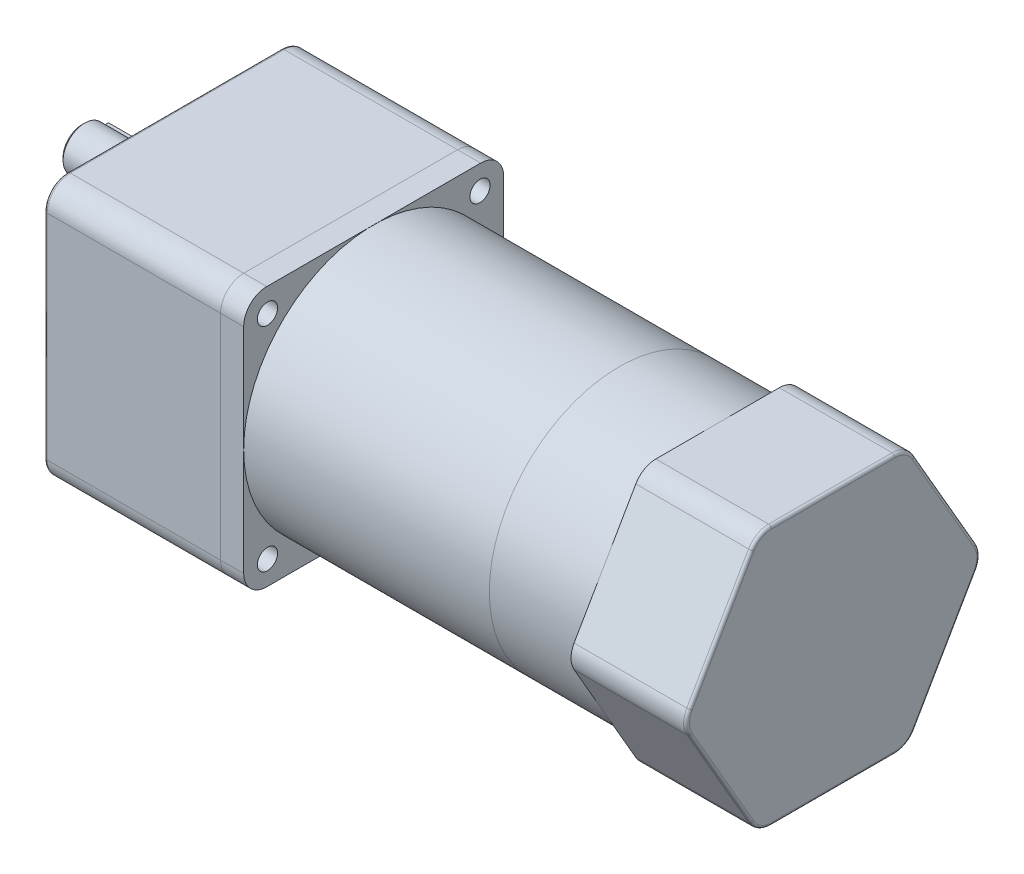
SolidWorks part; units mm, degrees
ref_plane "前视基准面" through (0, 0, 0) normal (0, 0, 1) x (1, 0, 0)
ref_plane "上视基准面" through (0, 0, 0) normal (0, 1, 0) x (1, 0, 0)
ref_plane "右视基准面" through (0, 0, 0) normal (1, 0, 0) x (0, 0, -1)
sketch "草图1" plane through (0, 0, 0) normal (1, 0, 0) x (0, 0, -1)
  line L1 (-37, -45) -> (37, -45)
  line L2 (-45, -37) -> (-45, 37)
  line L3 (-37, 45) -> (37, 45)
  line L4 (45, -37) -> (45, 37)
  line L5 (-45, -45) -> (45, 45) construction
  line L6 (-45, 45) -> (45, -45) construction
  arc A0 (-37, -45) -> (-45, -37) centre (-37, -37) cw
  arc A1 (-45, 37) -> (-37, 45) centre (-37, 37) cw
  arc A2 (37, 45) -> (45, 37) centre (37, 37) cw
  arc A3 (37, -45) -> (45, -37) centre (37, -37) ccw
  point P0 (0, 0)
  dimension "D1" = 8
extrude "凸台-拉伸1" add sketch "草图1" along normal blind 61
sketch "草图2" plane through (61, 0, 0) normal (1, 0, 0) x (0, 0, -1)
  line L0 (37, 45) -> (-37, 45) construction
  line L1 (-37, -45) -> (37, -45)
  line L2 (-45, -37) -> (-45, 37)
  line L3 (-37, 45) -> (37, 45)
  line L4 (45, -37) -> (45, 37)
  line L5 (-45, -45) -> (45, 45) construction
  line L6 (-45, 45) -> (45, -45) construction
  arc A0 (37, 45) -> (45, 37) centre (37, 37) cw
  arc A1 (37, -45) -> (45, -37) centre (37, -37) ccw
  arc A2 (-37, -45) -> (-45, -37) centre (-37, -37) cw
  arc A3 (-45, 37) -> (-37, 45) centre (-37, 37) cw
  point P0 (0, 0)
  dimension "D1" = 8
extrude "凸台-拉伸2" add sketch "草图2" along normal blind 8 separate body
sketch "草图3" plane through (69, 0, 0) normal (1, 0, 0) x (0, 0, -1)
  circle A0 centre (0, 0) radius 45
extrude "凸台-拉伸3" add sketch "草图3" along normal blind 85 separate body
sketch "草图4" plane through (154, 0, 0) normal (1, 0, 0) x (0, 0, -1)
  circle A0 centre (0, 0) radius 45
extrude "凸台-拉伸4" add sketch "草图4" along normal blind 34 separate body
sketch "草图5" plane through (188, 0, 0) normal (1, 0, 0) x (0, 0, -1)
  line L1 (21.362, 45) -> (-21.362, 45)
  line L2 (-28.2902, 41) -> (-49.6521, 4)
  line L3 (-49.6521, -4) -> (-28.2902, -41)
  line L4 (-21.362, -45) -> (21.362, -45)
  line L5 (28.2902, -41) -> (49.6521, -4)
  line L6 (49.6521, 4) -> (28.2902, 41)
  circle A0 centre (0, 0) radius 45 construction
  arc A1 (-49.6521, 4) -> (-49.6521, -4) centre (-42.7239, 0) ccw
  arc A2 (-28.2902, -41) -> (-21.362, -45) centre (-21.362, -37) ccw
  arc A3 (21.362, -45) -> (28.2902, -41) centre (21.362, -37) ccw
  arc A4 (49.6521, -4) -> (49.6521, 4) centre (42.7239, 0) ccw
  arc A5 (21.362, 45) -> (28.2902, 41) centre (21.362, 37) cw
  arc A6 (-21.362, 45) -> (-28.2902, 41) centre (-21.362, 37) ccw
  dimension "D1" = 8
extrude "凸台-拉伸5" add sketch "草图5" along normal blind 40 separate body
fillet "圆角1" radius 1 12 edges at (228, 22.5, 38.9711) (228, 43.9282, 25.362) (228, 45, 0) (228, 43.9282, -25.362) (228, 22.5, -38.9711) (228, 0, -50.7239) (228, -22.5, -38.9711) (228, -43.9282, -25.362) (228, -45, 0) (228, -43.9282, 25.362) (228, -22.5, 38.9711) (228, 0, 50.7239)
fillet "圆角2" radius 1 8 edges at (0, -45, 0) (0, -42.6569, -42.6569) (0, 0, -45) (0, 42.6569, -42.6569) (0, 45, 0) (0, 42.6569, 42.6569) (0, 0, 45) (0, -42.6569, 42.6569)
sketch "草图6" plane through (0, 0, 0) normal (-1, 0, 0) x (0, 0, 1)
  point P19 (36.7696, 36.7696)
  point P20 (36.7696, -36.7696)
  point P21 (-36.7696, -36.7696)
  point P22 (-36.7696, 36.7696)
hole_wizard "M6 螺纹孔1" positions "3D草图1" profile "草图7" tap size "M6" standard "GB"
sketch3d "3D草图1"
  point P0 (0, 36.7696, 36.7696)
  point P3 (0, -36.7696, 36.7696)
  point P6 (0, 36.7696, -36.7696)
  point P9 (0, -36.7696, -36.7696)
sketch "草图7" plane through (0, 36.7696, 36.7696) normal (0, 1, 0) x (0, 0, 1)
  line L0 (0, 0) -> (0, 18.5022)
  line L1 (0, 18.5022) -> (2.5, 17)
  line L2 (2.5, 17) -> (2.5, 0)
  line L5 (2.5, 0) -> (0, 0)
  line L10 (0, 18.5022) -> (-2.5, 17) construction
  line L11 (0, -6.35) -> (0, 107.95) construction
  dimension "螺纹孔钻头直径" = 5
  dimension "螺纹孔钻头深度" = 17
  dimension "导头角度" = 118
sketch "草图8" plane through (69, 0, 0) normal (1, 0, 0) x (0, 0, -1)
  line L1 (42.6569, -42.6569) -> (42.6569, 42.6569)
  arc A2 (37, -45) -> (45, -37) centre (37, -37) ccw construction
  arc A3 (45, 37) -> (37, 45) centre (37, 37) ccw construction
  circle A5 centre (-36.7696, 36.7696) radius 3.5
  circle A6 centre (36.7696, 36.7696) radius 3.5
  circle A7 centre (36.7696, -36.7696) radius 3.5
  circle A8 centre (-36.7696, -36.7696) radius 3.5
extrude "切除-拉伸1" cut sketch "草图8" against normal blind 26 contours A5 | A6 | A7 | A8
sketch "草图9" plane through (0, 0, 0) normal (-1, 0, 0) x (0, 0, 1)
  circle A0 centre (0, 18) radius 16
extrude "凸台-拉伸6" add sketch "草图9" along normal blind 3
fillet "圆角3" radius 0.5 1 edges at (-3, 18, 16)
sketch "草图10" plane through (0, 0, 0) normal (-1, 0, 0) x (0, 0, 1)
  circle A0 centre (0, 0) radius 41.4
extrude "切除-拉伸2" cut sketch "草图10" against normal blind 0.5
fillet "圆角4" radius 0.5 1 edges at (0, 0, 41.4)
sketch "草图11" plane through (-3, 0, 0) normal (-1, 0, 0) x (0, 0, 1)
  circle A0 centre (0, 18) radius 7.5
extrude "凸台-拉伸7" add sketch "草图11" along normal blind 29 separate body
ref_plane "基准面1" through (0, 0, -7.5) normal (0, 0, 1) x (1, 0, 0)
sketch "草图12" plane through (0, 0, -7.5) normal (0, 0, 1) x (1, 0, 0)
  line L1 (-32, 25.5) -> (-32, 10.5) construction
  line L2 (-9.5, 20.5) -> (-32, 20.5)
  line L3 (-32, 20.5) -> (-32, 15.5)
  line L4 (-32, 15.5) -> (-9.5, 15.5)
  arc A0 (-9.5, 15.5) -> (-9.5, 20.5) centre (-9.5, 18) ccw
extrude "切除-拉伸4" cut sketch "草图12" along normal blind 3
sketch "草图13" plane through (0, 0, -4.5) normal (0, 0, -1) x (-1, 0, 0)
  line L0 (9.5, 20.5) -> (32, 20.5)
  line L1 (32, 20.5) -> (32, 15.5)
  line L2 (32, 15.5) -> (9.5, 15.5)
  arc A0 (9.5, 20.5) -> (9.5, 15.5) centre (9.5, 18) ccw
extrude "凸台-拉伸8" add sketch "草图13" along normal blind 5 separate body
chamfer "倒角1" distance 0.3 angle 45 4 edges at (-7, 18, -9.5) (-20.75, 15.5, -9.5) (-32, 18, -9.5) (-20.75, 20.5, -9.5)
chamfer "倒角2" distance 1 angle 45 1 edges at (-32, 18, 7.5)
